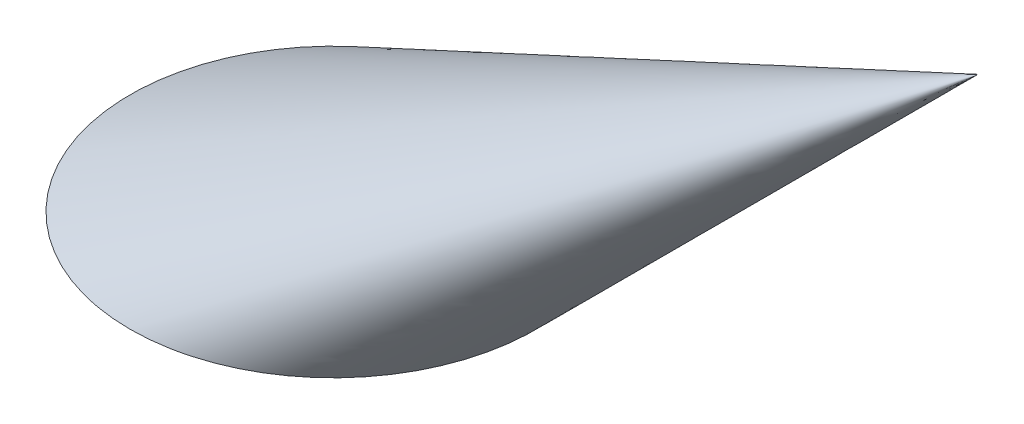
SolidWorks part; units mm, degrees
ref_plane "前视基准面" through (0, 0, 0) normal (0, 0, 1) x (1, 0, 0)
ref_plane "上视基准面" through (0, 0, 0) normal (0, 1, 0) x (1, 0, 0)
ref_plane "右视基准面" through (0, 0, 0) normal (1, 0, 0) x (0, 0, -1)
sketch "草图1" plane through (0, 0, 0) normal (0, 1, 0) x (1, 0, 0)
  line L0 (-460, 0) -> (460, 0) construction
  circle A0 centre (0, 0) radius 460
  dimension "D" = 920
sketch "草图2" plane through (0, 0, 0) normal (0, 0, 1) x (1, 0, 0)
  line L0 (1460, 1000) -> (-460, 0) construction
  line L1 (1460, 1000) -> (460, 0) construction
  line L2 (460, 0) -> (-460, 0) construction
  line L3 (-460, 0) -> (460, 0) construction
  dimension "H2" = 1000
  dimension "β" = 45
sketch "草图3" plane through (0, 0, 0) normal (0, 0, 1) x (1, 0, 0)
  point P0 (1460, 1000)
loft "放样1" add profiles "草图1", "草图3"
